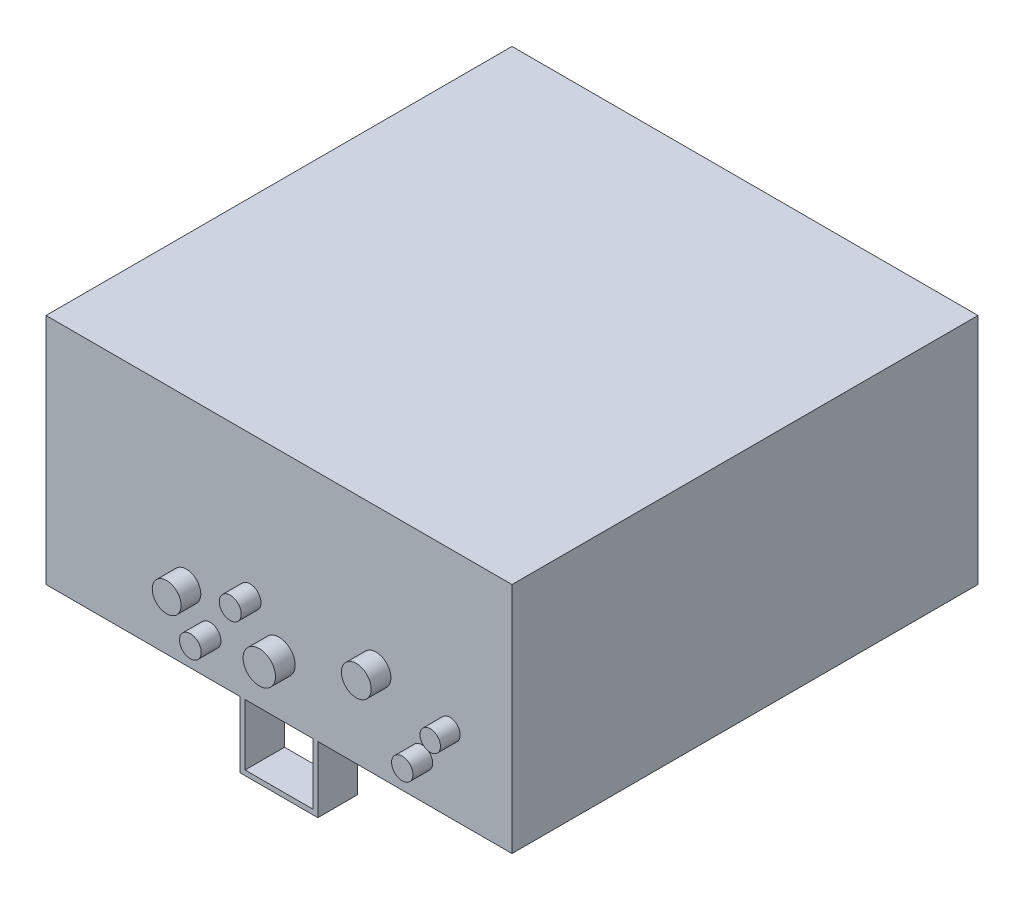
SolidWorks part; units mm, degrees
ref_plane "Front Plane" through (0, 0, 0) normal (0, 0, 1) x (1, 0, 0)
ref_plane "Top Plane" through (0, 0, 0) normal (0, 1, 0) x (1, 0, 0)
ref_plane "Right Plane" through (0, 0, 0) normal (1, 0, 0) x (0, 0, -1)
sketch "Sketch1" plane through (0, 0, 0) normal (0, 1, 0) x (1, 0, 0)
  line L0 (-300, -300) -> (300, 300)
  line L1 (-300, -300) -> (300, -300)
  line L2 (-300, -300) -> (-300, 300)
  line L3 (-300, 300) -> (300, 300)
  line L4 (300, -300) -> (300, 300)
  dimension "D1" = 600
  dimension "D2" = 600
extrude "Boss-Extrude1" add sketch "Sketch1" along normal blind 300 contours L3 L2 L0 | L1 L4 L0
sketch "Sketch2" plane through (0, 0, 300) normal (0, 0, 1) x (1, 0, 0)
  line L0 (-50, 0) -> (-50, -85)
  line L1 (-300, 0) -> (300, 0) construction
  line L2 (-50, -85) -> (50, -85)
  line L3 (50, -85) -> (50, 0)
  line L4 (-50, 0) -> (-43.65, 0)
  line L5 (-43.65, 0) -> (-43.65, -78.65)
  line L6 (-43.65, -78.65) -> (43.65, -78.65)
  line L7 (43.65, -78.65) -> (43.65, 0)
  line L8 (43.65, 0) -> (50, 0)
  line L9 (0, -78.65) -> (0, -85) construction
  point P10 (0, -78.65)
  point P11 (0, -85)
  dimension "D1" = 6.35
  dimension "D2" = 85
  dimension "D3" = 100
extrude "Boss-Extrude2" add sketch "Sketch2" against normal blind 50.8
mirror "Mirror1" about plane through (0, 0, 0) normal (0, 0, 1) of "Boss-Extrude2"
sketch "Sketch3" plane through (0, 0, 300) normal (0, 0, 1) x (1, 0, 0)
  circle A0 centre (-119.2681, 88.9982) radius 18.5534
  circle A1 centre (0, 70.4448) radius 20.8507
  circle A2 centre (124.9266, 117.9964) radius 19.1851
  circle A3 centre (184.0823, 49.5941) radius 13.7634
  circle A4 centre (220.0695, 98.8113) radius 13.2139
  circle A5 centre (-37.3573, 117.9964) radius 14.1519
  circle A6 centre (-88.7391, 49.5941) radius 13.994
extrude "Boss-Extrude3" add sketch "Sketch3" along normal blind 25.4
